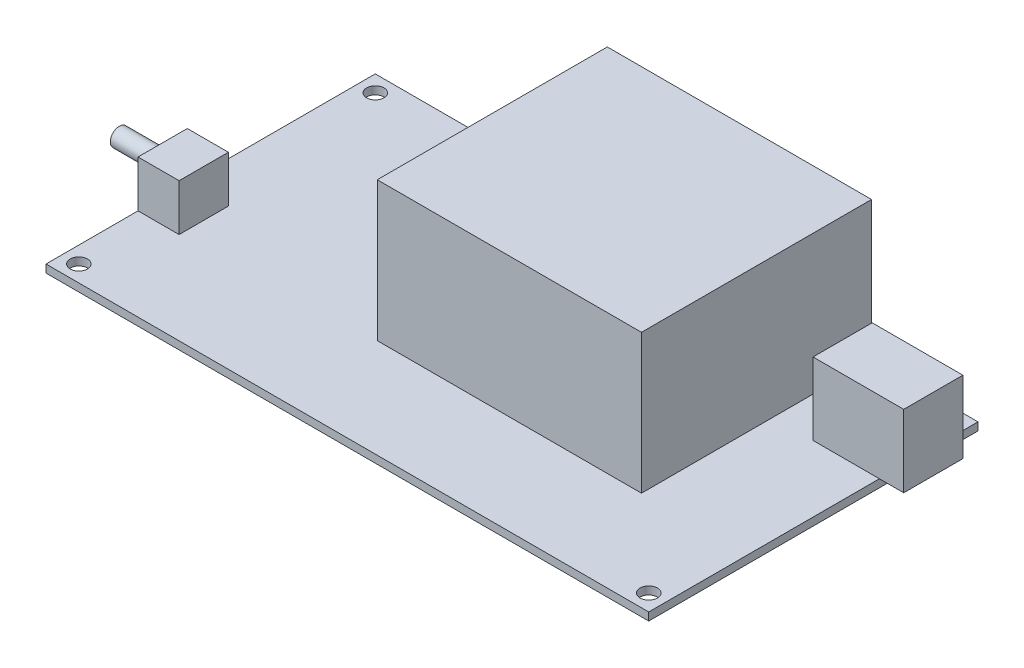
SolidWorks part; units mm, degrees
ref_plane "Front Plane" through (0, 0, 0) normal (0, 0, 1) x (1, 0, 0)
ref_plane "Top Plane" through (0, 0, 0) normal (0, 1, 0) x (1, 0, 0)
ref_plane "Right Plane" through (0, 0, 0) normal (1, 0, 0) x (0, 0, -1)
sketch "Sketch1"
  dimension "D3" = 2.64
  dimension "D4" = 2.5
  dimension "D6" = 2.5
  dimension "D8" = 2.64
  dimension "D9" = 2.64
  dimension "D10" = 2.64
  dimension "D1" = 91.7
  dimension "D2" = 50.1
  dimension "D5" = 2.5
  dimension "D7" = 2.5
  dimension "D11" = 2.5
  dimension "D12" = 2.5
  dimension "D13" = 2.5
  dimension "D14" = 2.5
extrude "Boss-Extrude1" add sketch "Sketch1" along normal blind 1.2
sketch "Sketch2" plane through (0, 1.2, 0) normal (0, 1, 0) x (1, 0, 0)
  line L1 (35.75, 19.05) -> (49.55, 19.05)
  line L2 (35.75, 19.05) -> (35.75, 10.05)
  line L3 (35.75, 10.05) -> (49.55, 10.05)
  line L4 (49.55, 19.05) -> (49.55, 10.05)
  line L5 (45.85, 25.05) -> (-45.85, 25.05) construction
  line L6 (45.85, -25.05) -> (45.85, 25.05) construction
  dimension "D1" = 9
  dimension "D2" = 13.8
  dimension "D3" = 6
  dimension "D4" = 3.7
extrude "Boss-Extrude2" add sketch "Sketch2" along normal blind 11 contours L2 L1 L4 L3
sketch "Sketch3" plane through (0, 1.2, 0) normal (0, 1, 0) x (1, 0, 0)
  line L0 (45.85, 25.05) -> (-45.85, 25.05) construction
  line L1 (29.65, 25.05) -> (-10.55, 25.05)
  line L2 (29.65, 25.05) -> (29.65, -9.95)
  line L3 (29.65, -9.95) -> (-10.55, -9.95)
  line L4 (-10.55, 25.05) -> (-10.55, -9.95)
  line L5 (45.85, -25.05) -> (45.85, 10.05) construction
  dimension "D1" = 16.2
  dimension "D2" = 40.2
  dimension "D3" = 35
extrude "Boss-Extrude3" add sketch "Sketch3" along normal blind 21.2
sketch "Sketch4" plane through (0, 1.2, 0) normal (0, 1, 0) x (1, 0, 0)
  line L0 (-45.85, -25.05) -> (45.85, -25.05) construction
  line L1 (-45.85, -3.55) -> (-39.6, -3.55)
  line L2 (-45.85, -3.55) -> (-45.85, -11.05)
  line L3 (-45.85, -11.05) -> (-39.6, -11.05)
  line L4 (-39.6, -3.55) -> (-39.6, -11.05)
  line L5 (-45.85, -3.55) -> (-39.6, -11.05) construction
  line L6 (-45.85, -11.05) -> (-39.6, -3.55) construction
  line L7 (-45.85, 25.05) -> (-45.85, -25.05) construction
  point P0 (-42.725, -7.3)
  dimension "D1" = 14
  dimension "D2" = 6.25
  dimension "D3" = 7.5
extrude "Boss-Extrude4" add sketch "Sketch4" along normal blind 7.1
sketch "Sketch5" plane through (-45.85, 0, 0) normal (-1, 0, 0) x (0, 0, 1)
  line L0 (11.05, 8.3) -> (11.05, 1.2) construction
  line L2 (3.55, 8.3) -> (11.05, 8.3) construction
  circle A0 centre (7.3, 5.8) radius 1.3736
  point P6 (7.101, 8.3)
  dimension "D1" = 3.75
  dimension "D2" = 2.5
extrude "Boss-Extrude5" add sketch "Sketch5" along normal blind 6.6
